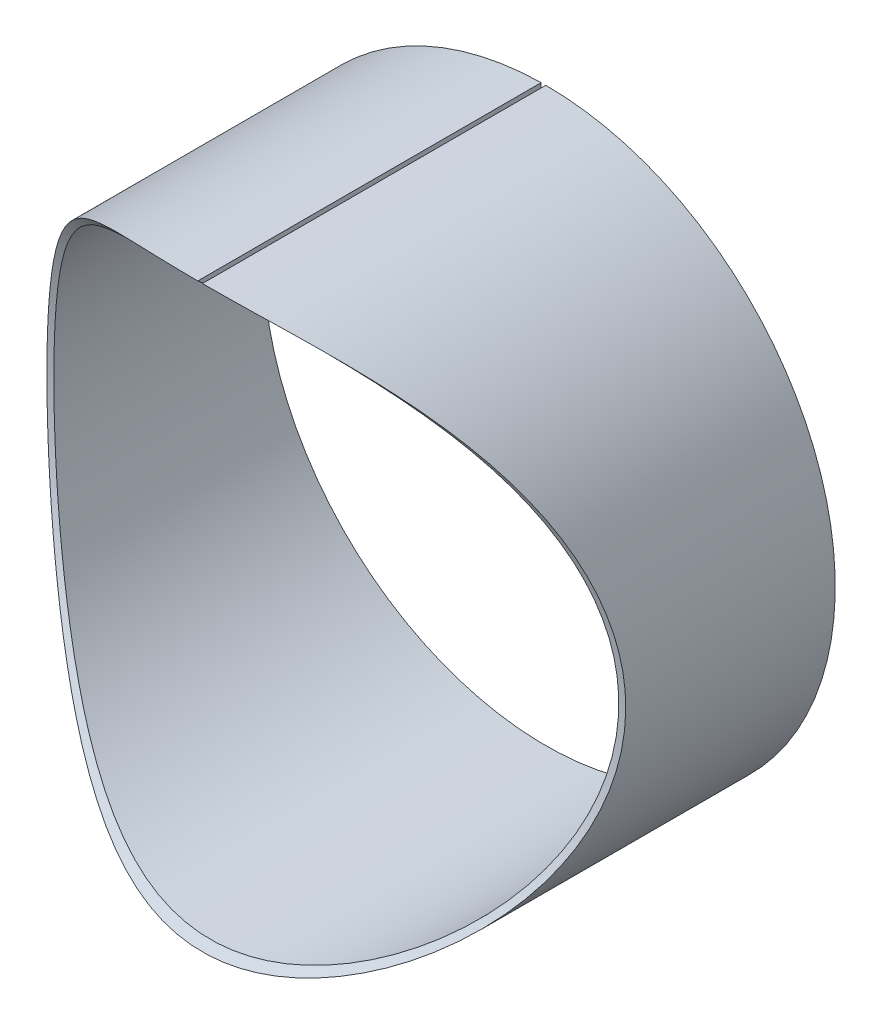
SolidWorks part; units mm, degrees
ref_plane "Ebene vorne" through (0, 0, 0) normal (0, 0, 1) x (1, 0, 0)
ref_plane "Ebene oben" through (0, 0, 0) normal (0, 1, 0) x (1, 0, 0)
ref_plane "Ebene rechts" through (0, 0, 0) normal (1, 0, 0) x (0, 0, -1)
sketch "Skizze1" plane through (0, 0, 0) normal (0, 0, 1) x (1, 0, 0)
  circle A0 centre (0, -80) radius 62.5 construction
  circle A1 centre (0, -80) radius 62.5
extrude "Linear-Austragen-Dünn1" add sketch "Skizze1" along normal up to surface (45.2345 mm away) thin
sketch "Skizze2" plane through (0, 0, 0) normal (0, 0, -1) x (-1, 0, 0)
  line L1 (0, -80) -> (1, -80)
  line L2 (0, -80) -> (0, -9.8752)
  line L3 (0, -9.8752) -> (1, -9.8752)
  line L4 (1, -80) -> (1, -9.8752)
  dimension "D1" = 1
extrude "Linear austragen1" cut sketch "Skizze2" against normal through all
